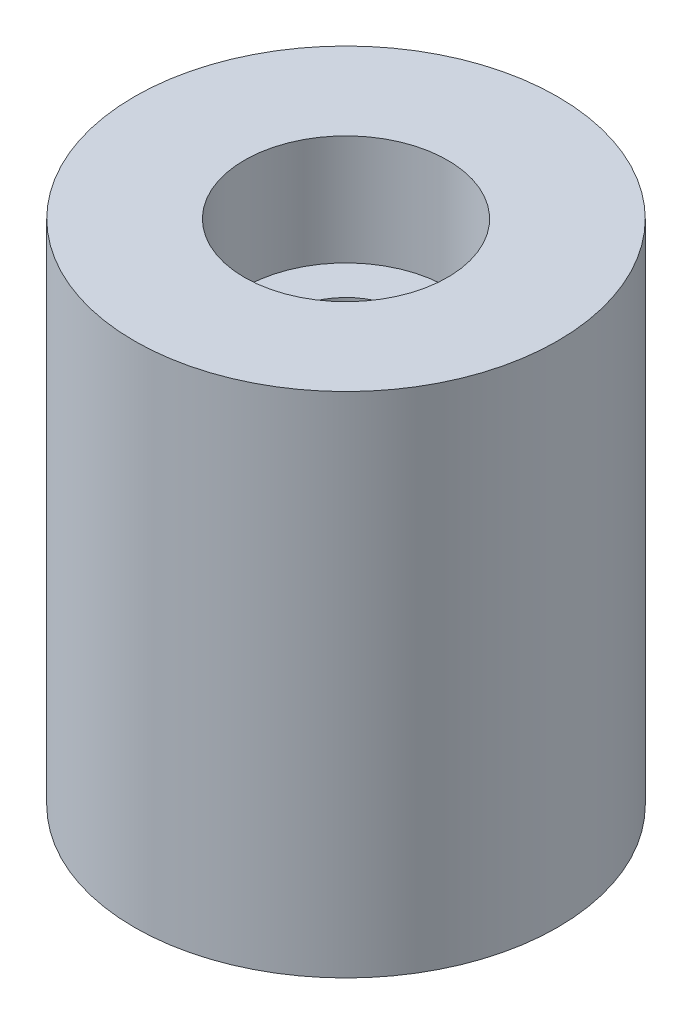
SolidWorks part; units mm, degrees
ref_plane "Plan de face" through (0, 0, 0) normal (0, 0, 1) x (1, 0, 0)
ref_plane "Plan de dessus" through (0, 0, 0) normal (0, 1, 0) x (1, 0, 0)
ref_plane "Plan de droite" through (0, 0, 0) normal (1, 0, 0) x (0, 0, -1)
sketch "Esquisse1" plane through (0, 0, 0) normal (0, 0, 1) x (1, 0, 0)
  line L0 (6, 0) -> (12.5, 0)
  line L1 (12.5, 0) -> (12.5, -30)
  line L2 (12.5, -30) -> (6, -30)
  line L3 (6, -30) -> (6, -34)
  line L4 (6, -34) -> (3.5, -34)
  line L5 (3.5, -34) -> (3.5, -6.5)
  line L6 (3.5, -6.5) -> (6, -6.5)
  line L7 (6, -6.5) -> (6, 0)
  line L8 (0, 12.5786) -> (0, -20.4533) construction
  dimension "D1" = 30
  dimension "D2" = 12.5
  dimension "D3" = 7
  dimension "D4" = 6
  dimension "D5" = 12
  dimension "D6" = 4
  dimension "D7" = 6.5
revolve "Révolution1" add sketch "Esquisse1" angle 360 about L8
